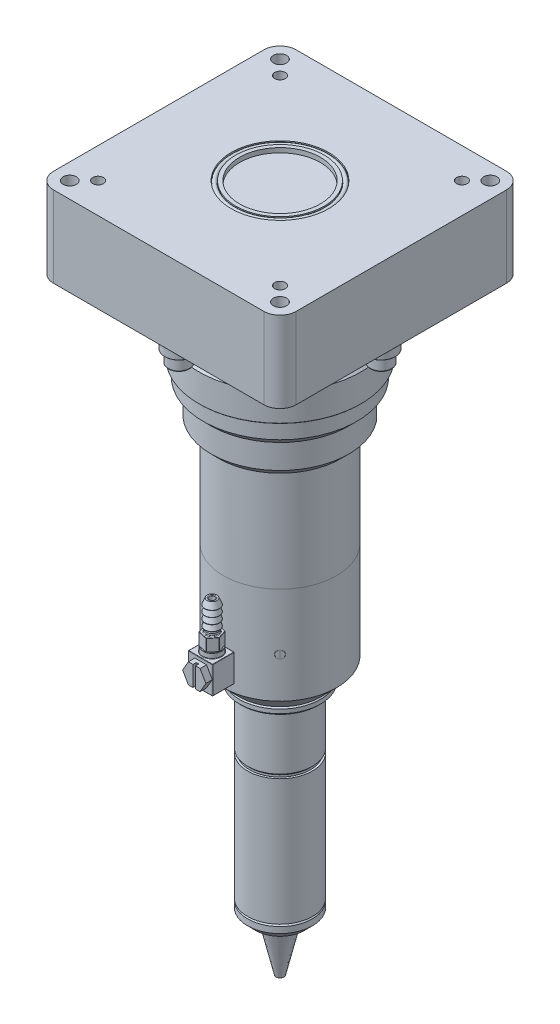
SolidWorks part; units mm, degrees
ref_plane "Front Plane" through (0, 0, 0) normal (0, 0, 1) x (1, 0, 0)
ref_plane "Top Plane" through (0, 0, 0) normal (0, 1, 0) x (1, 0, 0)
ref_plane "Right Plane" through (0, 0, 0) normal (1, 0, 0) x (0, 0, -1)
imported_body "Defeatured1"
hole_wizard "CBORE for M5 SHCS1" positions "Sketch1" profile "Sketch2" counterbore size "M5" standard "HAAS"
sketch "Sketch1" plane through (0, 0, 0) normal (0, -1, 0) x (-1, 0, 0)
  line L0 (0, 0) -> (58.9237, 0) construction
  line L2 (0, 0) -> (0, -50.0852) construction
  point P0 (-41.275, 41.275)
  point P2 (-41.275, 41.275)
  point P18 (41.275, 41.275)
  point P19 (41.275, -41.275)
  point P20 (-41.275, -41.275)
  dimension "D1" = 41.275
  dimension "D2" = 41.275
sketch "Sketch2" plane through (41.275, 0, -41.275) normal (1, 0, 0) x (0, 0, -1)
  line L0 (0, 0) -> (0, 31.75)
  line L1 (0, 31.75) -> (2.6035, 31.75)
  line L3 (2.6035, 31.75) -> (2.6035, 5.334)
  line L4 (2.6035, 5.334) -> (4.3561, 5.334)
  line L5 (4.3561, 5.334) -> (4.3561, 0)
  line L7 (4.3561, 0) -> (0, 0)
  line L11 (0, -6.35) -> (0, 107.95) construction
  dimension "Thru Hole Dia." = 5.207
  dimension "Thru Hole Depth" = 31.75
  dimension "C'Bore Dia." = 8.7122
  dimension "C'Bore Depth" = 5.334
